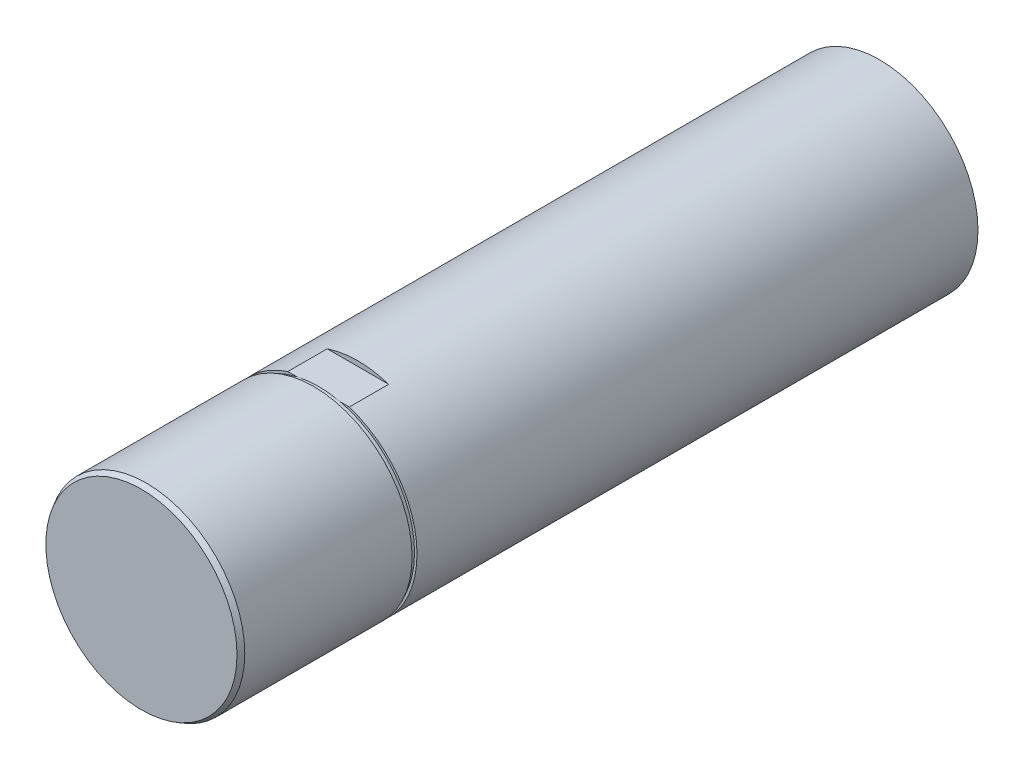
SolidWorks part; units mm, degrees
ref_plane "Front Plane" through (0, 0, 0) normal (0, 0, 1) x (1, 0, 0)
ref_plane "Top Plane" through (0, 0, 0) normal (0, 1, 0) x (1, 0, 0)
ref_plane "Right Plane" through (0, 0, 0) normal (1, 0, 0) x (0, 0, -1)
sketch "Sketch1" plane through (0, 0, 0) normal (0, 0, 1) x (1, 0, 0)
  circle A0 centre (0, 0) radius 20
  dimension "D1" = 40
extrude "STROKE" add sketch "Sketch1" against normal blind 100
sketch "Sketch2" plane through (0, 0, 0) normal (0, 0, 1) x (1, 0, 0)
  circle A0 centre (0, 0) radius 20
  dimension "D1" = 40
extrude "L2" add sketch "Sketch2" along normal blind 14
ref_plane "Plane1" through (0, 0, 14) normal (0, 0, 1) x (1, 0, 0)
sketch "Sketch3" plane through (0, 0, 14) normal (0, 0, 1) x (1, 0, 0)
  circle A0 centre (0, 0) radius 20
  dimension "D1" = 40
extrude "L3" add sketch "Sketch3" along normal blind 36
chamfer "Chamfer2" distance 1 angle 30 1 edges at (20, 0, 50)
sketch "Sketch5" plane through (0, 0, 14) normal (0, 0, 1) x (1, 0, 0)
  circle A0 centre (0, 0) radius 20
  circle A1 centre (0, 0) radius 19.5
  circle A4 centre (0, 0) radius 20 construction
  dimension "D1" = 40
  dimension "D2" = 39
extrude "U/C" cut sketch "Sketch5" along normal blind 1
sketch "Sketch6" plane through (0, 0, 0) normal (1, 0, 0) x (0, 0, -1)
  line L0 (-50, 19.4226) -> (-50, -19.4226) construction
  line L1 (-14, 20.5) -> (-6, 20.5)
  line L2 (-14, -19) -> (-14, -20.5)
  line L3 (-14, 19) -> (-6, 19)
  line L4 (-6, 20.5) -> (-6, 19)
  line L5 (-14, -19) -> (-6, -19)
  line L6 (-14, 20.5) -> (-14, 19)
  line L7 (-14, -20.5) -> (-6, -20.5)
  line L8 (-6, -19) -> (-6, -20.5)
  line L9 (100, -20) -> (100, 20) construction
  line L10 (100, 0) -> (-14, 0) construction
  line L12 (100, 0) -> (-14, 0) construction
  dimension "D1" = 8
  dimension "D2" = 38
  dimension "D3" = 19
  dimension "D4" = 36
  dimension "D5" = 41
  dimension "D6" = 40
  dimension "D7" = 20.5
extrude "A/F" cut sketch "Sketch6" against normal mid plane 21
equation "\"D2@Sketch5\" = \"D1@Sketch5\" - 1"
equation "\"D5@Sketch6\" = \"D2@Sketch6\"+3"
equation "\"D3@Sketch6\" = \"D2@Sketch6\" / 2"
equation "\"D2@Sketch6\" = \"D6@Sketch6\"-2"
equation "\"D7@Sketch6\" = \"D5@Sketch6\"/2"
